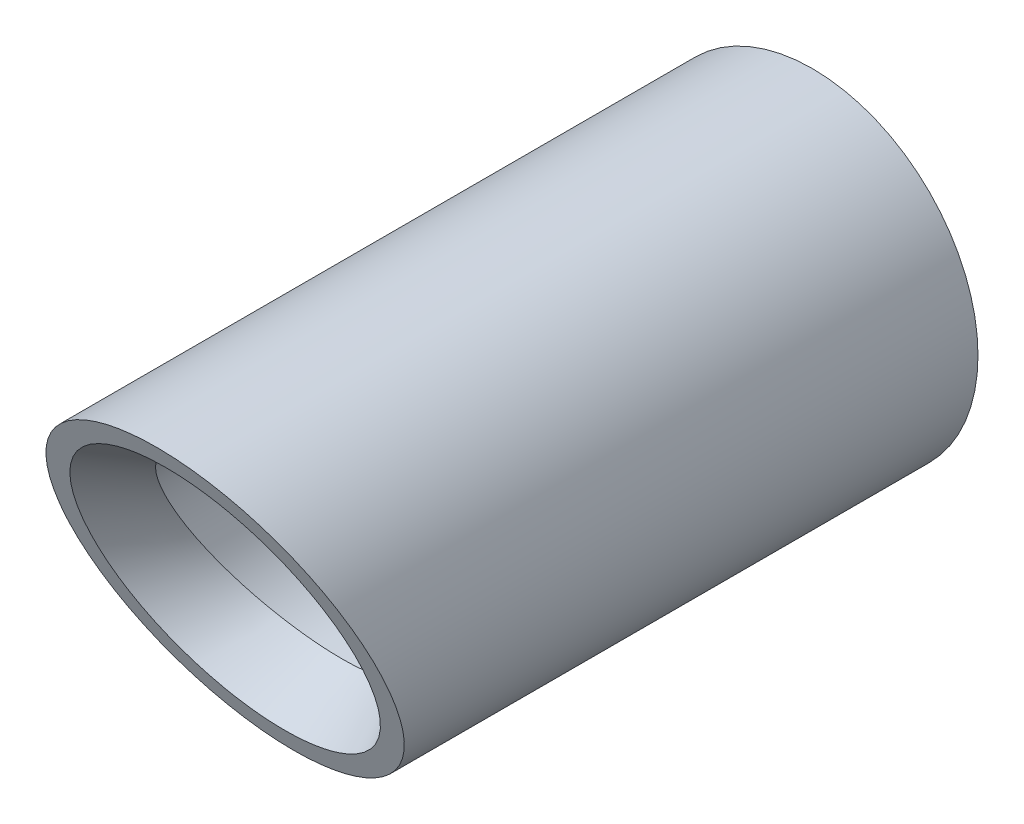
SolidWorks part; units mm, degrees
ref_plane "Vorne" through (0, 0, 0) normal (0, 0, 1) x (1, 0, 0)
ref_plane "Oben" through (0, 0, 0) normal (0, 1, 0) x (1, 0, 0)
ref_plane "Rechts" through (0, 0, 0) normal (1, 0, 0) x (0, 0, -1)
sketch "Skizze1" plane through (0, 0, 0) normal (0, 0, 1) x (1, 0, 0)
  circle A0 centre (0, 0) radius 5
  circle A1 centre (0, 0) radius 7.5
  dimension "D1" = 10
  dimension "D2" = 15
extrude "Linear austragen1" add sketch "Skizze1" along normal blind 30
sketch "Skizze2" plane through (0, 0, 0) normal (1, 0, 0) x (0, 0, -1)
  line L0 (-30, 7.5) -> (-23.7868, -7.5)
  line L1 (-30, -7.5) -> (0, -7.5) construction
  line L2 (-30, 7.5) -> (-30, -7.5) construction
  dimension "D1" = 22.5
extrude "Schnitt-Linear austragen1" cut sketch "Skizze2" against normal through all and the other way through all flip side to cut
sketch "Skizze3" plane through (0, 0, 0) normal (1, 0, 0) x (0, 0, -1)
  line L0 (-26.9877, 5) -> (-29.5858, 6.5)
  line L1 (-30, 7.5) -> (-23.7868, -7.5) construction
  line L2 (-26.9877, 5) -> (-32.6805, 5) construction
  dimension "D1" = 30
  dimension "D2" = 6.5
  dimension "D3" = 5
  dimension "D4" = 142.5
sketch "Skizze4" plane through (0, 0, 0) normal (1, 0, 0) x (0, 0, -1)
  line L0 (-24.8223, -5) -> (-32.6963, -5) construction
  line L1 (-24.201, -6.5) -> (-21.6029, -5)
  line L2 (-30, 7.5) -> (-23.7868, -7.5) construction
  line L3 (-24.8223, -5) -> (0, -5) construction
  dimension "D1" = 30
  dimension "D2" = 6.5
  dimension "D3" = 82.5
  dimension "D4" = 97.5
chamfer "Fase1" distance 3 angle 30 1 edges at (5, 0, 0)
sketch "Skizze5" plane through (0, 0, 0) normal (1, 0, 0) x (0, 0, -1)
  line L0 (-1.7321, 5) -> (-0.2887, 7.5)
  line L1 (-1.7321, 5) -> (-0.2887, 7.5)
  line L2 (0, -6.7321) -> (-3, -5)
  line L4 (-1.7321, 5) -> (-28.9645, 5) construction
  line L5 (-0.2887, -7.5) -> (-0.2887, 7.5) construction
  point P0 (28.0528, 11.5786)
  dimension "D1" = 60
  dimension "D2" = 30
sketch "Skizze6" plane through (0, 0, 0) normal (0, 1, 0) x (1, 0, 0)
  line L0 (5, -26.8934) -> (5, -32.0399) construction
  line L1 (6.5, -26.8934) -> (5, -24.2953)
  line L2 (5, -26.8934) -> (5, -1.7321) construction
  line L3 (0, -1.7321) -> (0, -0.2887) construction
  dimension "D1" = 6.5
  dimension "D2" = 30
sketch "Skizze7" plane through (0, -9.5083, 22.955) normal (0, -0.3827, 0.9239) x (1, 0, 0)
  ellipse E0 centre (0, 10.2917) end of major axis (0, 3.2561) minor radius 6.5
surface "Oberfläche-Linear austragen1" sketch "Skizze7" parameters "D1"=4.1, "D2"=4.1, "D3"=30
other "Oberflächenschnitt1"
